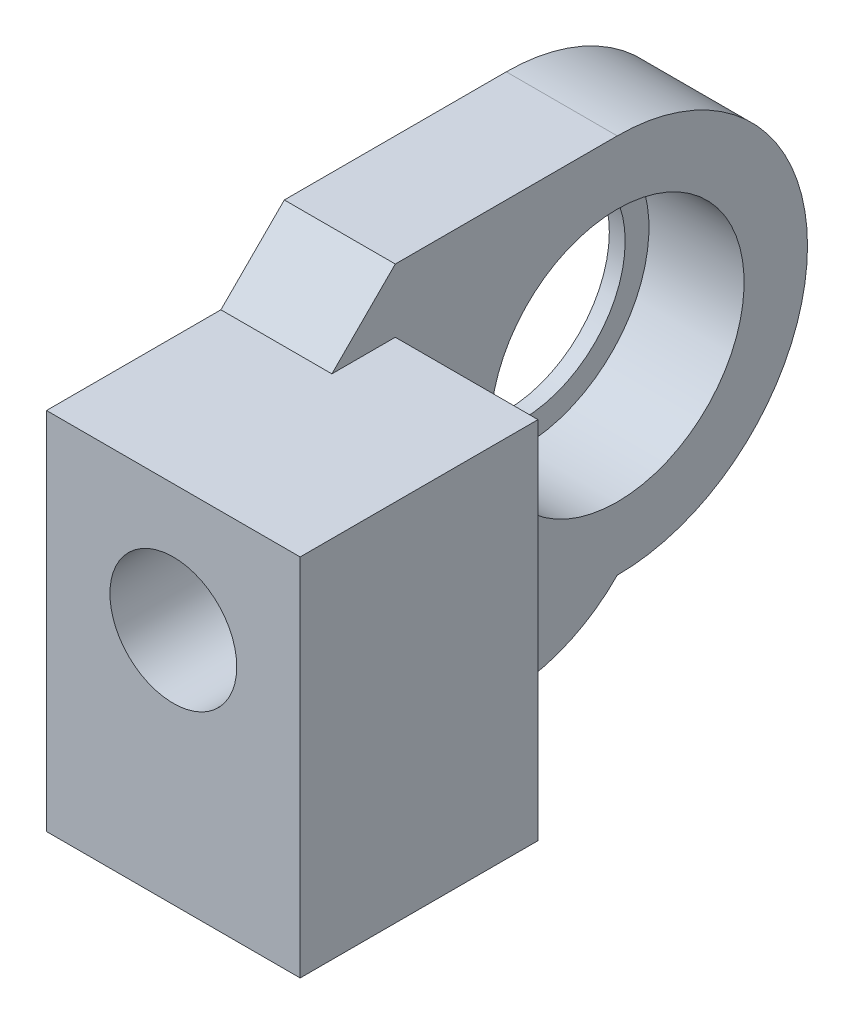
SolidWorks part; units mm, degrees
ref_plane "Alzado" through (0, 0, 0) normal (0, 0, 1) x (1, 0, 0)
ref_plane "Planta" through (0, 0, 0) normal (0, 1, 0) x (1, 0, 0)
ref_plane "Vista lateral" through (0, 0, 0) normal (1, 0, 0) x (0, 0, -1)
sketch "Croquis1" plane through (0, 0, 0) normal (0, 0, 1) x (1, 0, 0)
  line L1 (8, 8) -> (-8, 8)
  line L2 (8, 8) -> (8, -15)
  line L3 (8, -15) -> (-8, -15)
  line L4 (-8, 8) -> (-8, -15)
  circle A0 centre (0, 0) radius 4
  point P7 (0, 0)
  point P8 (0, 8)
  dimension "D1" = 8
  dimension "D2" = 16
  dimension "D3" = 8
  dimension "D4" = 15
extrude "Saliente-Extruir1" add sketch "Croquis1" along normal blind 10
sketch "Croquis2" plane through (0, 0, 0) normal (0, 0, -1) x (-1, 0, 0)
  line L4 (-8, 8) -> (-8, -15)
  line L5 (-8, -15) -> (8, -15)
  line L6 (8, -15) -> (8, 8)
  line L7 (8, 8) -> (-8, 8)
  line L8 (-8, 8) -> (-8, -15)
  line L9 (-8, -15) -> (8, -15)
  line L10 (8, -15) -> (8, 8)
  line L11 (8, 8) -> (-8, 8)
  dimension "D1" = 0
extrude "Saliente-Extruir2" add sketch "Croquis2" along normal blind 5
sketch "Croquis3" plane through (-8, 0, 0) normal (1, 0, 0) x (0, 0, -1)
  line L0 (5, 8) -> (5, -15) construction
  line L1 (19, -12) -> (19, -15)
  line L2 (19, -15) -> (5, -15)
  line L3 (5, -15) -> (5, 12)
  line L4 (5, 12) -> (19, 12)
  circle A0 centre (19, 0) radius 8
  arc A1 (19, 12) -> (19, -12) centre (19, 0) cw
  point P7 (5, 12.6592)
  point P13 (0, 0)
  dimension "D2" = 12
  dimension "D3" = 16
  dimension "D1" = 14
extrude "Saliente-Extruir3" add sketch "Croquis3" along normal blind 7
fillet "Redondeo1" radius 10 1 edges at (-4.5, -15, -19)
chamfer "Chaflán1" distance 4 angle 45 1 edges at (-4.5, 8, -5)
sketch "Croquis5" plane through (-8, 0, 0) normal (1, 0, 0) x (0, 0, -1)
  circle A0 centre (19, 0) radius 8 construction
  circle A1 centre (19, 0) radius 8
  circle A2 centre (19, 0) radius 6.5
  dimension "D1" = 1.5
extrude "Saliente-Extruir4" add sketch "Croquis5" along normal blind 1
